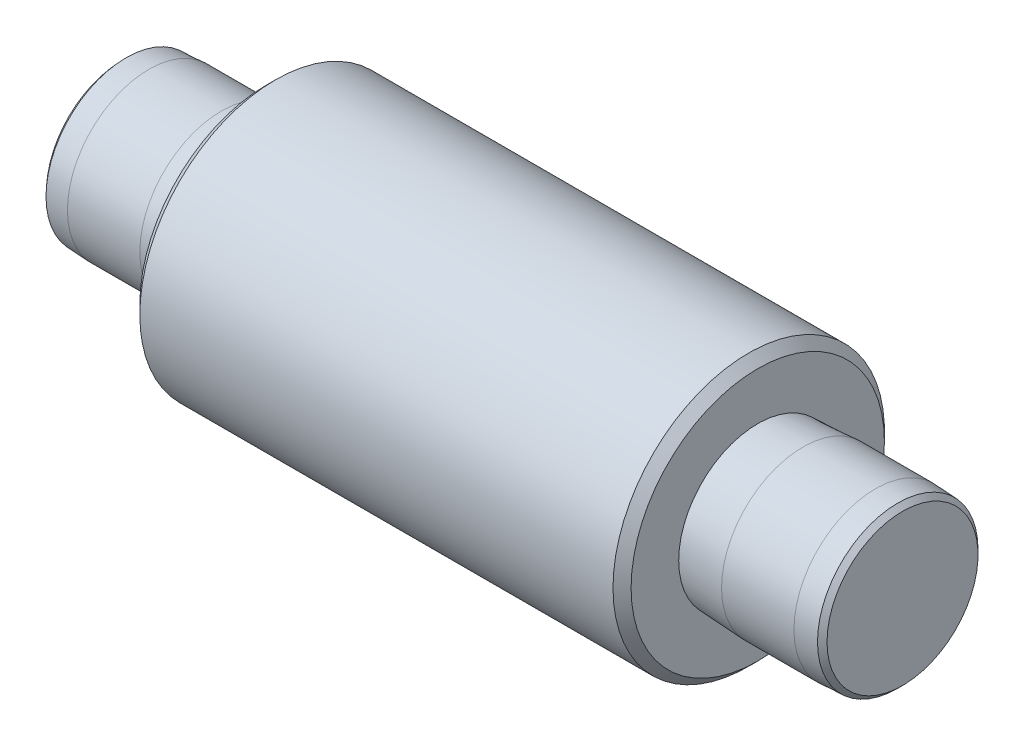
SolidWorks part; units mm, degrees
ref_plane "Plan1" through (0, 0, 0) normal (0, 0, 1) x (1, 0, 0)
ref_plane "Plan2" through (0, 0, 0) normal (0, 1, 0) x (1, 0, 0)
ref_plane "Plan3" through (0, 0, 0) normal (1, 0, 0) x (0, 0, -1)
sketch "Esquisse1" plane through (0, 0, 0) normal (0, 0, 1) x (1, 0, 0)
  line L0 (-130, 0) -> (110, 0) construction
  line L1 (-112.8381, 8.8428) -> (-109.8381, 9)
  line L2 (-109.8381, 9) -> (-101.8381, 9)
  line L3 (-101.8381, 9) -> (-96.8381, 8.738)
  line L4 (-112.8381, 8.8428) -> (-112.8381, 0)
  line L5 (-96.8381, 8.738) -> (-96.8381, 15)
  line L6 (-96.8381, 15) -> (-42.5381, 15)
  line L14 (-42.5381, 8.738) -> (-42.5381, 15)
  line L15 (-26.5381, 8.8428) -> (-26.5381, 0)
  line L16 (-37.5381, 9) -> (-42.5381, 8.738)
  line L17 (-29.5381, 9) -> (-37.5381, 9)
  line L18 (-26.5381, 8.8428) -> (-29.5381, 9)
  line L19 (-112.8381, 0) -> (-26.5381, 0)
  dimension "D1" = 9
  dimension "D2" = 3
  dimension "D3" = 3
  dimension "D4" = 8
  dimension "D5" = 3
  dimension "D6" = 5
  dimension "D7" = 15
  dimension "D8" = 54.3
  dimension "D9" = 8
  dimension "D10" = 5
  dimension "D11" = 9
  dimension "D12" = 3
revolve "Base-Révolution" add sketch "Esquisse1" angle 360 about L0
ref_plane "Plan4" through (-69.4381, 0, 0) normal (1, 0, 0) x (0, 0, -1)
chamfer "Chanfrein1" distance 1 angle 45 2 edges at (-42.5381, 0, 15) (-96.8381, 0, 15)
chamfer "Chanfrein2" distance 0.5 angle 45 2 edges at (-26.5381, 0, 8.8428) (-112.8381, 0, 8.8428)
